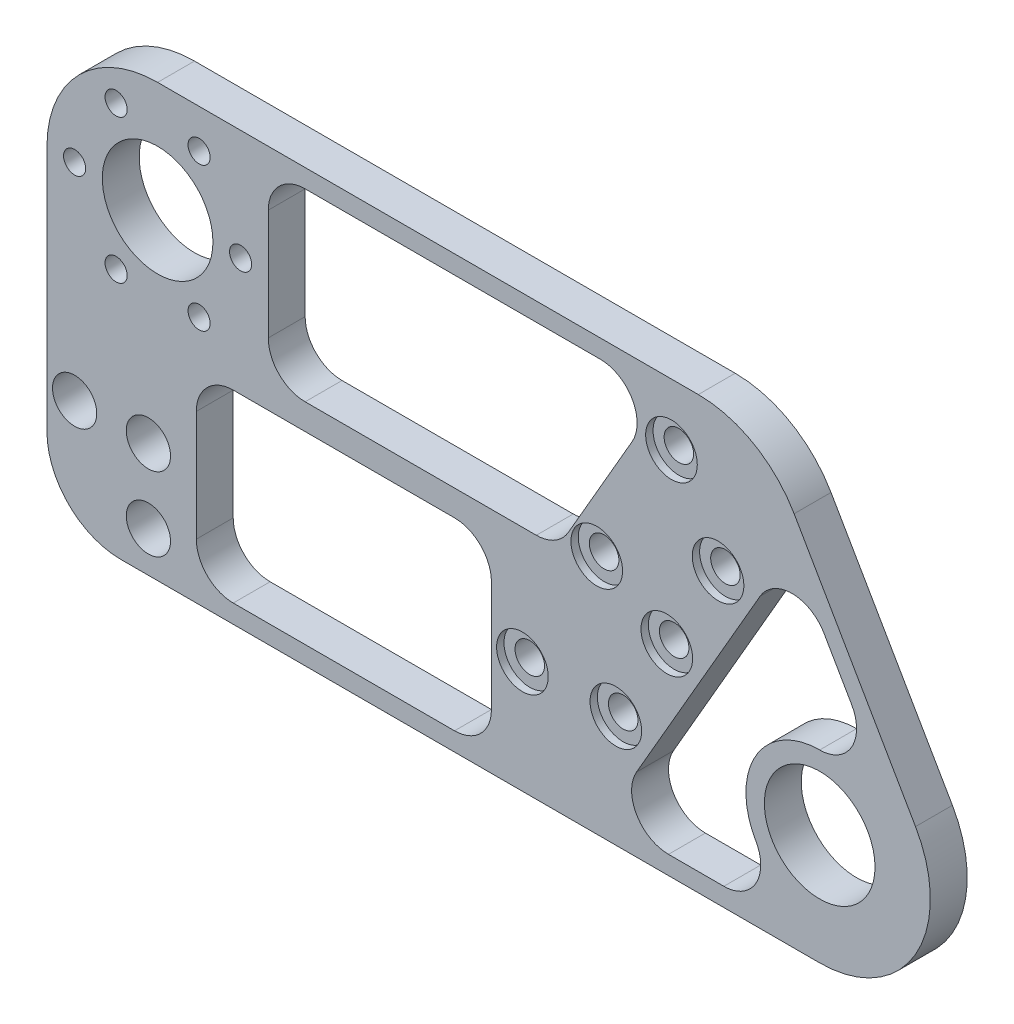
SolidWorks part; units mm, degrees
ref_plane "Plan de face" through (0, 0, 0) normal (0, 0, 1) x (1, 0, 0)
ref_plane "Plan de dessus" through (0, 0, 0) normal (0, 1, 0) x (1, 0, 0)
ref_plane "Plan de droite" through (0, 0, 0) normal (1, 0, 0) x (0, 0, -1)
sketch "Esquisse1" plane through (0, 0, 0) normal (0, 0, 1) x (1, 0, 0)
  line L0 (20, 0) -> (209.5, 0)
  line L1 (235.4808, 45) -> (202.5718, 102)
  line L2 (176.591, 117) -> (30, 117)
  line L3 (0, 87) -> (0, 20)
  line L4 (30, 87) -> (41.25, 106.4856) construction
  line L5 (30, 87) -> (52.5, 87) construction
  line L6 (30, 87) -> (18.75, 106.4856) construction
  line L7 (41.25, 67.5144) -> (30, 87) construction
  line L8 (30, 87) -> (18.75, 67.5144) construction
  line L9 (60, 102) -> (60, 72)
  line L10 (70, 62) -> (132.6795, 62)
  line L11 (141.3397, 67) -> (158.6603, 97)
  line L12 (150, 112) -> (70, 112)
  line L13 (183.5192, 5) -> (168.5081, 5)
  line L14 (50.5, 55) -> (110.5, 55)
  line L15 (40.5, 45) -> (40.5, 15)
  line L16 (50.5, 5) -> (110.5, 5)
  line L17 (120.5, 45) -> (120.5, 15)
  line L18 (159.8479, 20) -> (193.3342, 78)
  line L19 (210.6547, 78) -> (218.1603, 65)
  line L20 (209.5, 30) -> (7.5, 31) construction
  line L21 (209.5, 30) -> (69.2682, 111.8911) construction
  line L22 (209.5, 30) -> (146.2218, 140.865) construction
  line L23 (119.3711, -30.1078) -> (226.2002, 154.9256) construction
  line L24 (95.5106, -27.4355) -> (206.8382, 165.3897) construction
  arc A0 (209.5, 0) -> (235.4808, 45) centre (209.5, 30) ccw
  arc A1 (202.5718, 102) -> (176.591, 117) centre (176.591, 87) ccw
  arc A2 (30, 117) -> (0, 87) centre (30, 87) ccw
  arc A3 (20, 0) -> (0, 20) centre (20, 20) cw
  circle A4 centre (30, 87) radius 15
  circle A5 centre (7.5, 87) radius 3
  circle A6 centre (18.75, 67.5144) radius 3
  circle A7 centre (41.25, 67.5144) radius 3
  circle A8 centre (52.5, 87) radius 3
  circle A9 centre (41.25, 106.4856) radius 3
  circle A10 centre (18.75, 106.4856) radius 3
  circle A11 centre (30, 87) radius 22.5 construction
  circle A12 centre (7.5, 31) radius 6
  circle A13 centre (27.5, 31) radius 6
  circle A14 centre (27.5, 11) radius 6
  arc A15 (158.6603, 97) -> (150, 112) centre (150, 102) ccw
  arc A16 (132.6795, 62) -> (141.3397, 67) centre (132.6795, 72) ccw
  arc A17 (60, 72) -> (70, 62) centre (70, 72) ccw
  arc A18 (60, 102) -> (70, 112) centre (70, 102) cw
  arc A19 (110.5, 55) -> (120.5, 45) centre (110.5, 45) cw
  arc A20 (110.5, 5) -> (120.5, 15) centre (110.5, 15) ccw
  arc A21 (40.5, 15) -> (50.5, 5) centre (50.5, 15) ccw
  arc A22 (50.5, 55) -> (40.5, 45) centre (50.5, 45) ccw
  circle A23 centre (209.5, 30) radius 15
  arc A24 (218.1603, 65) -> (209.5, 50) centre (209.5, 60) cw
  arc A25 (209.5, 50) -> (192.1795, 20) centre (209.5, 30) ccw
  arc A26 (192.1795, 20) -> (183.5192, 5) centre (183.5192, 15) cw
  circle A27 centre (181.9461, 78.2752) radius 4
  circle A28 centre (168.0496, 54.2058) radius 4
  circle A29 centre (154.2323, 30.2736) radius 4
  circle A30 centre (128.9013, 30.399) radius 4
  circle A31 centre (149.0515, 65.3001) radius 4
  circle A32 centre (169.3172, 100.4013) radius 4
  arc A33 (168.5081, 5) -> (159.8479, 20) centre (168.5081, 15) cw
  arc A34 (193.3342, 78) -> (210.6547, 78) centre (201.9944, 73) cw
  point P13 (0, 0)
  point P41 (167.3205, 112)
  point P46 (60, 62)
  point P49 (60, 112)
  point P58 (120.5, 5)
  point P61 (40.5, 5)
  point P64 (40.5, 55)
  dimension "D1" = 30
  dimension "D2" = 20
  dimension "D4" = 6
  dimension "D5" = 6
  dimension "D6" = 6
  dimension "D7" = 6
  dimension "D8" = 6
  dimension "D9" = 6
  dimension "D10" = 30
  dimension "D11" = 45
  dimension "D16" = 12
  dimension "D17" = 12
  dimension "D18" = 12
  dimension "D28" = 10
  dimension "D32" = 10
  dimension "D33" = 30
  dimension "D36" = 20
  dimension "D37" = 10
  dimension "D38" = 10
  dimension "D45" = 8
  dimension "D46" = 10
  dimension "D3" = 60
  dimension "D12" = 60
  dimension "D13" = 60
  dimension "D14" = 60
  dimension "D15" = 60
  dimension "D19" = 20
  dimension "D20" = 20
  dimension "D21" = 56
  dimension "D22" = 11
  dimension "D23" = 80
  dimension "D24" = 30
  dimension "D25" = 120
  dimension "D26" = 5
  dimension "D27" = 50
  dimension "D29" = 5
  dimension "D30" = 50
  dimension "D31" = 80
  dimension "D34" = 38
  dimension "D35" = 5
  dimension "D39" = 89
  dimension "D40" = 182
  dimension "D41" = 30
  dimension "D42" = 30
  dimension "D43" = 48
  dimension "D44" = 22
extrude "Boss.-Extru.1" add sketch "Esquisse1" along normal blind 10
sketch "Esquisse2" plane through (0, 0, 10) normal (0, 0, 1) x (1, 0, 0)
  circle A0 centre (149.0515, 65.3001) radius 7
  circle A1 centre (169.3172, 100.4013) radius 7
  circle A2 centre (181.9461, 78.2752) radius 7
  circle A3 centre (168.0496, 54.2058) radius 7
  circle A4 centre (154.2323, 30.2736) radius 7
  circle A5 centre (128.9013, 30.399) radius 7
  dimension "D1" = 14
extrude "Enlèv. mat.-Extru.1" cut sketch "Esquisse2" against normal blind 2
